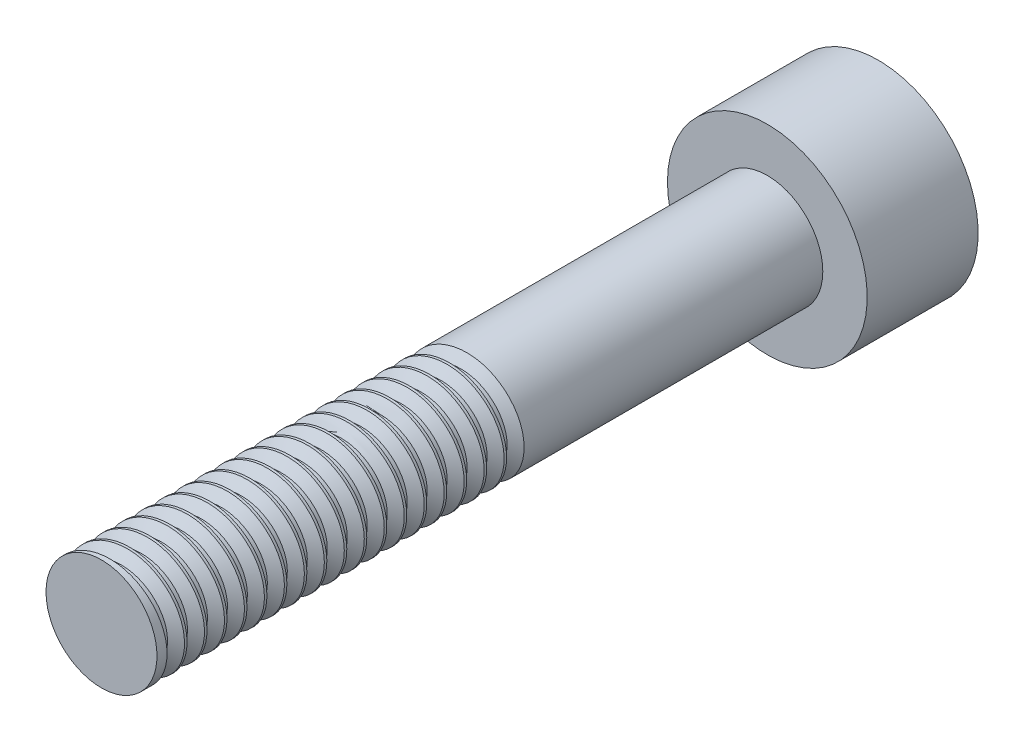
SolidWorks part; units mm, degrees
ref_plane "Ebene vorne" through (0, 0, 0) normal (0, 0, 1) x (1, 0, 0)
ref_plane "Ebene oben" through (0, 0, 0) normal (0, 1, 0) x (1, 0, 0)
ref_plane "Ebene rechts" through (0, 0, 0) normal (1, 0, 0) x (0, 0, -1)
sketch "Skizze1" plane through (0, 0, 0) normal (0, 0, 1) x (1, 0, 0)
  circle A0 centre (0, 0) radius 1.25
  dimension "D1" = 2.5
extrude "Aufsatz-Linear austragen1" add sketch "Skizze1" along normal blind 15
thread "Gewinde1" pitch 0.45 start angle 0, offset 0, length 8, pitch 0.45, diameter 2.5
ref_plane "Ebene1" through (-1.25, 0, 15) normal (0, -1, 0) x (-1, 0, 0)
sketch "Gewindeprofil1" plane through (-1.25, 0, 15) normal (0, -1, 0) x (-1, 0, 0)
  line L0 (0, 0) -> (0, 0.45) construction
  line L11 (0, 0) -> (0, 0.3937)
  line L12 (0, 0.3937) -> (-0.2436, 0.2531)
  line L13 (-0.2436, 0.2531) -> (-0.2436, 0.1406)
  line L15 (-0.2436, 0.1406) -> (0, 0)
  line L17 (-0.2436, 0.1969) -> (0, 0.1969) construction
  point P2 (0, 0)
  dimension "Pitch" = 0.45
  dimension "Profile_Angle" = 60
  dimension "Profile_Land" = 0.1125
  dimension "Profile_Height" = 0.2436
sketch "Skizze5" plane through (0, 0, 0) normal (0, 0, -1) x (-1, 0, 0)
  circle A0 centre (0, 0) radius 2.25
  dimension "D1" = 4.5
extrude "Aufsatz-Linear austragen2" add sketch "Skizze5" along normal blind 2.5
sketch "Skizze6" plane through (0, 0, -2.5) normal (0, 0, -1) x (-1, 0, 0)
  line L1 (1.5629, 0) -> (0.7815, 1.3535)
  line L2 (0.7815, 1.3535) -> (-0.7815, 1.3535)
  line L3 (-0.7815, 1.3535) -> (-1.5629, 0)
  line L4 (-1.5629, 0) -> (-0.7815, -1.3535)
  line L5 (-0.7815, -1.3535) -> (0.7815, -1.3535)
  line L6 (0.7815, -1.3535) -> (1.5629, 0)
  circle A0 centre (0, 0) radius 1.3535 construction
extrude "Schnitt-Linear austragen1" cut sketch "Skizze6" against normal blind 1.5
